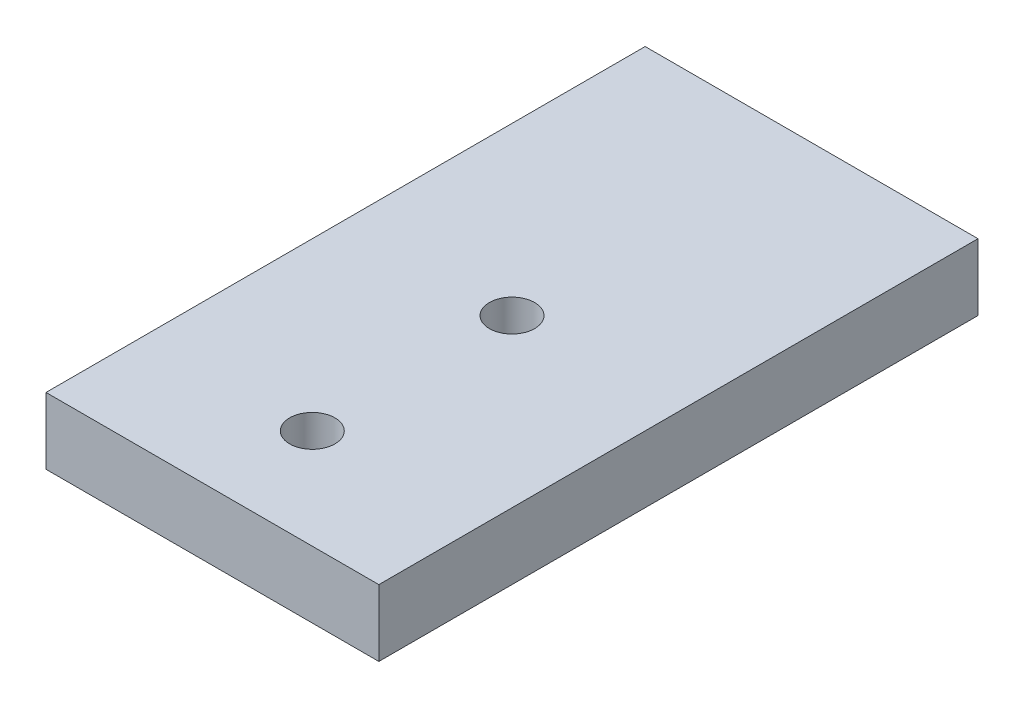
SolidWorks part; units mm, degrees
ref_plane "Plan de face" through (0, 0, 0) normal (0, 0, 1) x (1, 0, 0)
ref_plane "Plan de dessus" through (0, 0, 0) normal (0, 1, 0) x (1, 0, 0)
ref_plane "Plan de droite" through (0, 0, 0) normal (1, 0, 0) x (0, 0, -1)
sketch "Esquisse1" plane through (0, 0, 0) normal (0, 0, 1) x (1, 0, 0)
  line L1 (0, 10) -> (50, 10)
  line L2 (0, 10) -> (0, 0)
  line L3 (0, 0) -> (50, 0)
  line L4 (50, 10) -> (50, 0)
  dimension "D1" = 10
  dimension "D2" = 50
extrude "Extrusion1" add sketch "Esquisse1" along normal mid plane 90
hole_wizard "Trou taraudé M81" positions "Esquisse3" profile "Esquisse2" tap size "M8" standard "ISO"
sketch "Esquisse3" plane through (0, 10, 0) normal (0, 1, 0) x (-1, 0, 0)
  line L0 (0, 45) -> (0, -45) construction
  line L1 (-50, 45) -> (0, 45) construction
  point P0 (-25, 30)
  point P7 (-25, 0)
  dimension "D1" = 25
  dimension "D2" = 15
  dimension "D3" = 30
sketch "Esquisse2" plane through (25, 10, 30) normal (1, 0, 0) x (0, 0, 1)
  line L0 (0, 0) -> (0, 24.2929)
  line L1 (0, 24.2929) -> (3.4, 22.25)
  line L2 (3.4, 22.25) -> (3.4, 0)
  line L5 (3.4, 0) -> (0, 0)
  line L10 (0, 24.2929) -> (-3.4, 22.25) construction
  line L11 (0, -6.35) -> (0, 107.95) construction
  dimension "Diamètre du trou pour taraudage" = 6.8
  dimension "Profondeur du trou pour taraudage" = 22.25
  dimension "Angle de pointe" = 118
